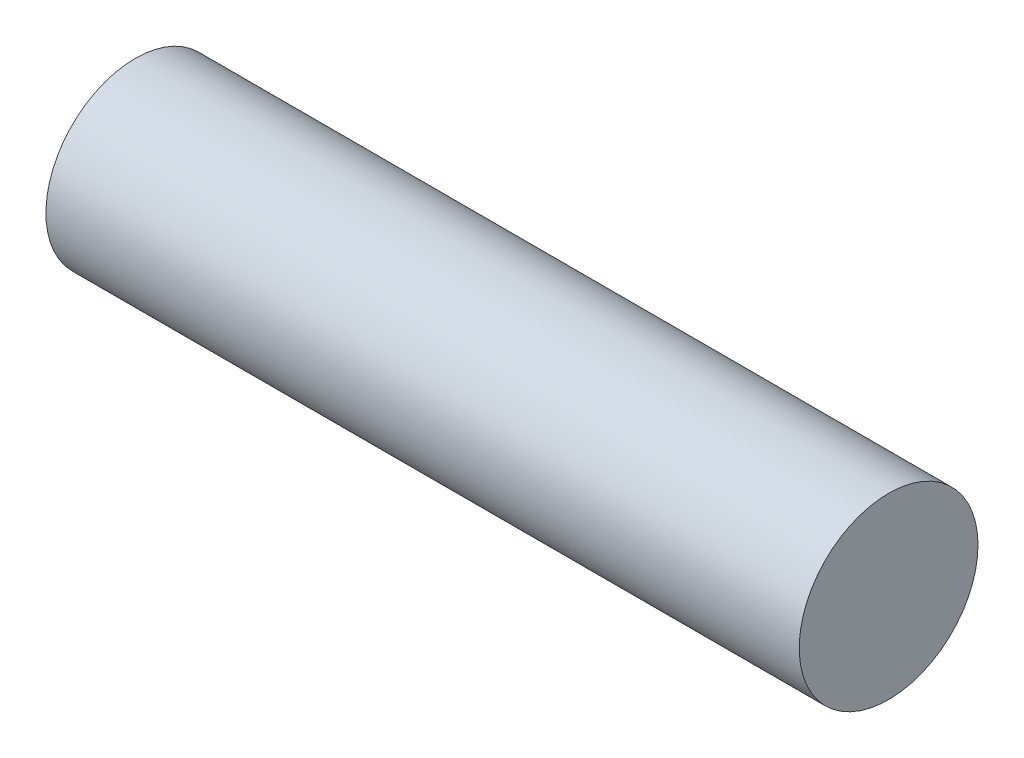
SolidWorks part; units mm, degrees
ref_plane "Vorne" through (0, 0, 0) normal (0, 0, 1) x (1, 0, 0)
ref_plane "Oben" through (0, 0, 0) normal (0, 1, 0) x (1, 0, 0)
ref_plane "Rechts" through (0, 0, 0) normal (1, 0, 0) x (0, 0, -1)
sketch "Skizze1" plane through (0, 0, 0) normal (0, 0, 1) x (1, 0, 0)
  line L0 (12.445, 1.25) -> (12.445, 0) construction
  line L1 (0, 0) -> (12.445, 0) construction
  line L3 (12.445, 1.25) -> (12.445, 0)
  line L4 (2.26, 0) -> (12.445, 0)
  line L5 (12.445, 1.25) -> (1.9098, 1.25) construction
  line L6 (0, 0) -> (-0.9635, 0) construction
  line L7 (0, 0) -> (-0.9635, 0) construction
  line L10 (12.445, 1.25) -> (1.9098, 1.25)
  arc A0 (2.26, 0) -> (1.505, 1.75) centre (-0.1457, 0) ccw construction
  arc A1 (2.26, 0) -> (1.9098, 1.25) centre (-0.1457, 0) ccw
revolve "Rotation1" add sketch "Skizze1" angle 360 about L7
